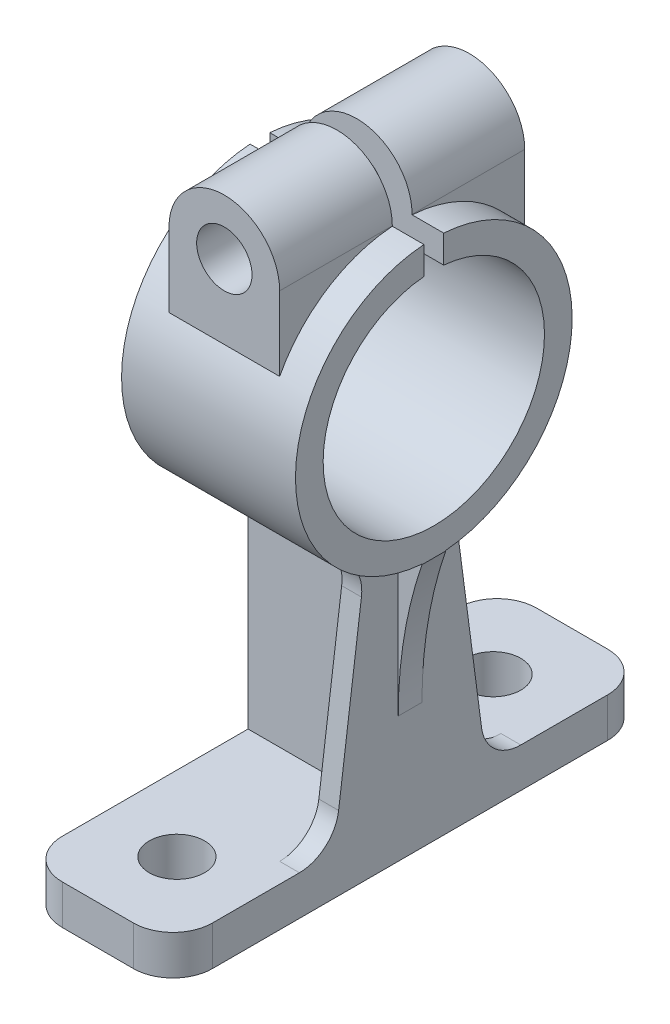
SolidWorks part; units mm, degrees
ref_plane "Front Plane" through (0, 0, 0) normal (0, 0, 1) x (1, 0, 0)
ref_plane "Top Plane" through (0, 0, 0) normal (0, 1, 0) x (1, 0, 0)
ref_plane "Right Plane" through (0, 0, 0) normal (1, 0, 0) x (0, 0, -1)
sketch "Sketch1" plane through (0, 0, 0) normal (0, 1, 0) x (1, 0, 0)
  line L1 (-38, 60) -> (0, 60)
  line L2 (-38, 60) -> (-38, -60)
  line L3 (-38, -60) -> (0, -60)
  line L4 (0, 60) -> (0, -60)
  dimension "D1" = 38
  dimension "D2" = 120
extrude "Extrude1" add sketch "Sketch1" along normal blind 10
sketch "Sketch2" plane through (0, 0, 0) normal (1, 0, 0) x (0, 0, -1)
  line L0 (0, 0) -> (0, 103) construction
  circle A0 centre (0, 103) radius 35
  dimension "D1" = 70
  dimension "D2" = 103
extrude "Extrude3" add sketch "Sketch2" against normal up to vertex (38 mm away) and the other way offset from surface (6 mm away) 6
sketch "Sketch5" plane through (0, 0, 0) normal (1, 0, 0) x (0, 0, -1)
  line L0 (-12.3098, 62.5657) -> (-18.0856, 18.6947)
  line L1 (-60, 10) -> (60, 10) construction
  line L2 (0, 10) -> (0, 103) construction
  line L3 (12.3098, 62.5657) -> (18.0856, 18.6947)
  line L4 (-28, 10) -> (28, 10)
  arc A0 (-18.0856, 18.6947) -> (-28, 10) centre (-28, 20) cw
  arc A1 (-12.3098, 62.5657) -> (-17.2855, 72.5663) centre (-22.2243, 63.871) ccw
  circle A2 centre (0, 103) radius 35 construction
  arc A3 (12.3098, 62.5657) -> (17.2855, 72.5663) centre (22.2243, 63.871) cw
  arc A4 (18.0856, 18.6947) -> (28, 10) centre (28, 20) ccw
  arc A5 (-17.2855, 72.5663) -> (17.2855, 72.5663) centre (0, 103) ccw
  dimension "D1" = 10
  dimension "D2" = 15
  dimension "D3" = 56
extrude "Extrude4" add sketch "Sketch5" against normal blind 5
sketch "Sketch6" plane through (0, 0, 0) normal (0, 0, 1) x (1, 0, 0)
  line L0 (-38, 10) -> (-38, 72.5663)
  line L2 (0, 72.5663) -> (6, 72.5663)
  line L3 (6, 68) -> (6, 138) construction
  line L4 (-38, 72.5663) -> (-5, 72.5663)
  line L5 (-38, 10) -> (-5, 10)
  line L6 (6, 72.5663) -> (6, 68)
  line L8 (0, 62.5657) -> (0, 18.6947) construction
  line L12 (0, 72.5663) -> (0, 31.8337)
  line L13 (-5, 72.5663) -> (-5, 10)
  arc A0 (0, 31.8337) -> (6, 68) centre (112, 31.8337) cw
  dimension "D1" = 112
extrude "Extrude8" add sketch "Sketch6" along normal mid plane 6
sketch "Sketch7" plane through (0, 0, 0) normal (0, 0, 1) x (1, 0, 0)
  line L0 (-16, 138) -> (-16, 103.3082) construction
  line L1 (6, 138) -> (-38, 138) construction
  line L2 (-30, 118) -> (-30, 138)
  line L3 (-2, 138) -> (-2, 118)
  line L4 (-2, 118) -> (-30, 118)
  arc A0 (-30, 138) -> (-2, 138) centre (-16, 138) cw
  dimension "D1" = 14
  dimension "D2" = 20
extrude "Extrude9" add sketch "Sketch7" along normal mid plane 62
sketch "Sketch8" plane through (6, 0, 0) normal (1, 0, 0) x (0, 0, -1)
  line L0 (31, 152) -> (-31, 152) construction
  line L2 (2.5, 130.8882) -> (2.5, 152)
  line L3 (-2.5, 130.8882) -> (-2.5, 152)
  line L4 (0, 103) -> (0, 126.5125) construction
  line L5 (2.5, 152) -> (-2.5, 152)
  arc A0 (-2.5, 130.8882) -> (2.5, 130.8882) centre (0, 103) ccw
  dimension "D3" = 56
  dimension "D1" = 5
extrude "Cut-Extrude1" cut sketch "Sketch8" against normal up to next
hole_wizard "Ø14.0 (14) Diameter Hole1" positions "Sketch11" profile "Sketch12" hole size "Ø14.0" standard "Ansi Metric"
sketch "Sketch11" plane through (0, 0, 31) normal (0, 0, 1) x (1, 0, 0)
  point P0 (-16, 138)
sketch "Sketch12" plane through (-16, 138, 31) normal (1, 0, 0) x (0, -1, 0)
  line L0 (0, 0) -> (0, 91)
  line L1 (0, 91) -> (7, 91)
  line L2 (7, 91) -> (7, 0)
  line L5 (7, 0) -> (0, 0)
  line L11 (0, -6.35) -> (0, 107.95) construction
  dimension "Thru Hole Dia." = 14
  dimension "Thru Hole Depth" = 91
hole_wizard "Ø14.0 (14) Diameter Hole2" positions "Sketch14" profile "Sketch13" hole size "Ø14.0" standard "Ansi Metric"
sketch "Sketch14" plane through (0, 10, 0) normal (0, 1, 0) x (-1, 0, 0)
  line L0 (38, 40) -> (0, 40) construction
  line L1 (38, 3) -> (38, 60) construction
  line L2 (0, 60) -> (0, 28) construction
  line L3 (38, 60) -> (0, 60) construction
  line L7 (0, 0) -> (-26.1831, 0) construction
  point P0 (19, 40)
  point P19 (19, -40)
  dimension "D1" = 20
sketch "Sketch13" plane through (-19, 10, 40) normal (1, 0, 0) x (0, 0, 1)
  line L0 (0, 0) -> (0, 10)
  line L1 (0, 10) -> (7, 10)
  line L2 (7, 10) -> (7, 0)
  line L5 (7, 0) -> (0, 0)
  line L11 (0, -6.35) -> (0, 107.95) construction
  dimension "Thru Hole Dia." = 14
  dimension "Thru Hole Depth" = 10
fillet "Fillet1" radius 10 4 edges at (0, 5, -60) (0, 5, 60) (-38, 5, -60) (-38, 5, 60)
